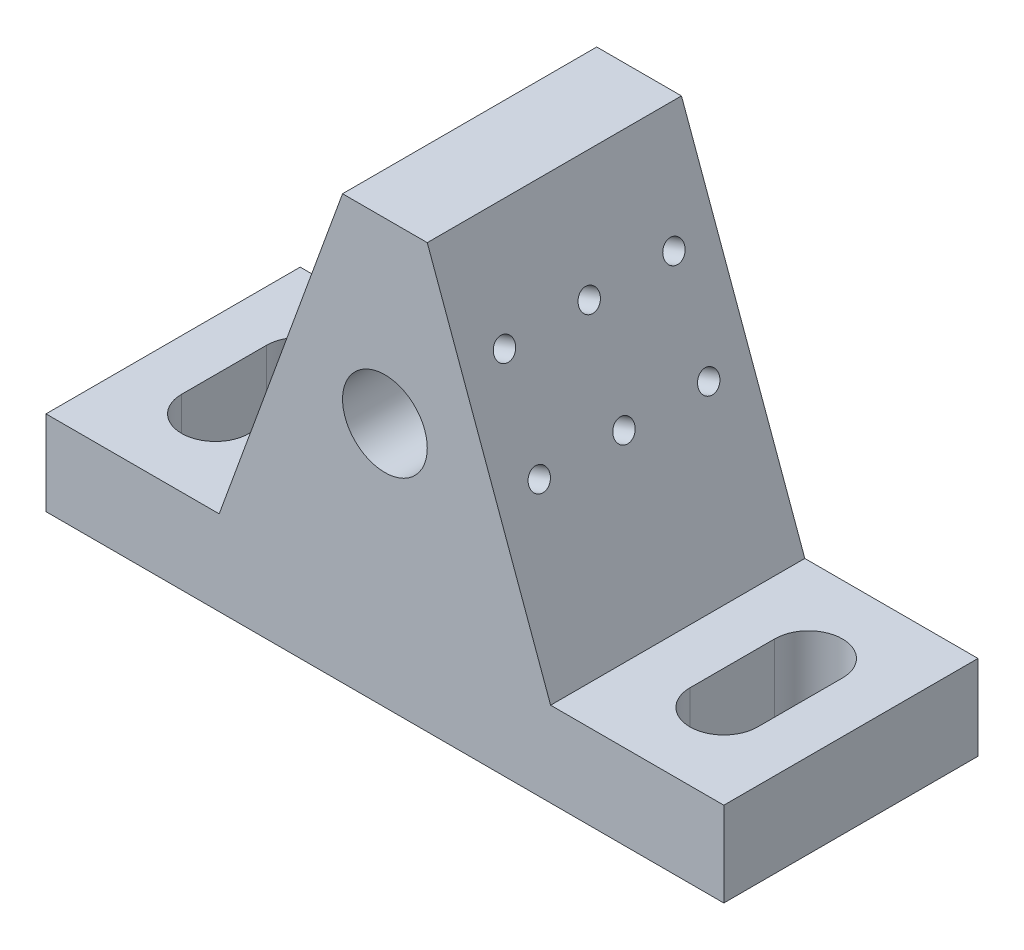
SolidWorks part; units mm, degrees
ref_plane "Front Plane" through (0, 0, 0) normal (0, 0, 1) x (1, 0, 0)
ref_plane "Top Plane" through (0, 0, 0) normal (0, 1, 0) x (1, 0, 0)
ref_plane "Right Plane" through (0, 0, 0) normal (1, 0, 0) x (0, 0, -1)
sketch "Sketch1" plane through (0, 0, 0) normal (0, 0, 1) x (1, 0, 0)
  line L0 (0, 0) -> (0, 51.3756) construction
  line L1 (-40, 0) -> (40, 0)
  line L2 (40, 0) -> (40, 10)
  line L3 (-40, 0) -> (-40, 10)
  line L4 (40, 10) -> (19.5588, 10)
  line L5 (-40, 10) -> (-19.5588, 10)
  line L6 (19.5588, 10) -> (5, 50)
  line L7 (-19.5588, 10) -> (-5, 50)
  line L8 (5, 50) -> (-5, 50)
  point P11 (0, 50)
  dimension "D1" = 110
  dimension "D2" = 50
  dimension "D3" = 10
  dimension "D4" = 10
  dimension "D5" = 80
extrude "Base Extrude" add sketch "Sketch1" along normal mid plane 30
sketch "Sketch2" plane through (0, 10, 0) normal (0, 1, 0) x (1, 0, 0)
  line L0 (30, -5) -> (30, 5) construction
  line L1 (26, -5) -> (26, 5)
  line L2 (34, -5) -> (34, 5)
  line L3 (40, 15) -> (19.5588, 15) construction
  arc A0 (26, -5) -> (34, -5) centre (30, -5) ccw
  arc A1 (34, 5) -> (26, 5) centre (30, 5) ccw
  point P2 (30, 0)
  dimension "D4" = 4
  dimension "D1" = 30
  dimension "D2" = 10
  dimension "D3" = 10
extrude "Slot Cut" cut sketch "Sketch2" against normal through all
mirror "Mirror1" about plane through (0, 0, 0) normal (1, 0, 0) of "Slot Cut"
sketch "Sketch3" plane through (0, 0, 15) normal (0, 0, 1) x (1, 0, 0)
  line L0 (-40, 0) -> (40, 0) construction
  circle A0 centre (0, 29) radius 5
  dimension "D1" = 10
  dimension "D2" = 29
extrude "Guide Hole" cut sketch "Sketch3" against normal through all
hole_wizard "M3x0.5 Tapped Hole1" positions "Sketch5" profile "Sketch4" tap size "M3x0.5" standard "Ansi Metric"
sketch "Sketch5" plane through (20.4848, 7.4559, 0) normal (0.9397, 0.342, 0) x (0, 0, -1)
  line L0 (15, 2.7074) -> (15, 45.2745) construction
  line L1 (15, 27.2511) -> (-15, 27.2511) construction
  point P0 (-10, 21.2511)
  dimension "D1" = 25
  dimension "D2" = 6
sketch "Sketch4" plane through (13.2165, 27.4253, 10) normal (0, 0, 1) x (-0.342, 0.9397, 0)
  line L0 (0, 0) -> (0, 8.2511)
  line L1 (0, 8.2511) -> (1.25, 7.5)
  line L2 (1.25, 7.5) -> (1.25, 0)
  line L5 (1.25, 0) -> (0, 0)
  line L10 (0, 8.2511) -> (-1.25, 7.5) construction
  line L11 (0, -6.35) -> (0, 107.95) construction
  dimension "Tap Drill Dia." = 2.5
  dimension "Tap Drill Depth" = 7.5
  dimension "Drill Angle" = 118
pattern_linear "LPattern1" count 3 spacing 10 along (0, 0, -1) count 2 spacing 12 along (-0.342, 0.9397, 0) of "M3x0.5 Tapped Hole1"
